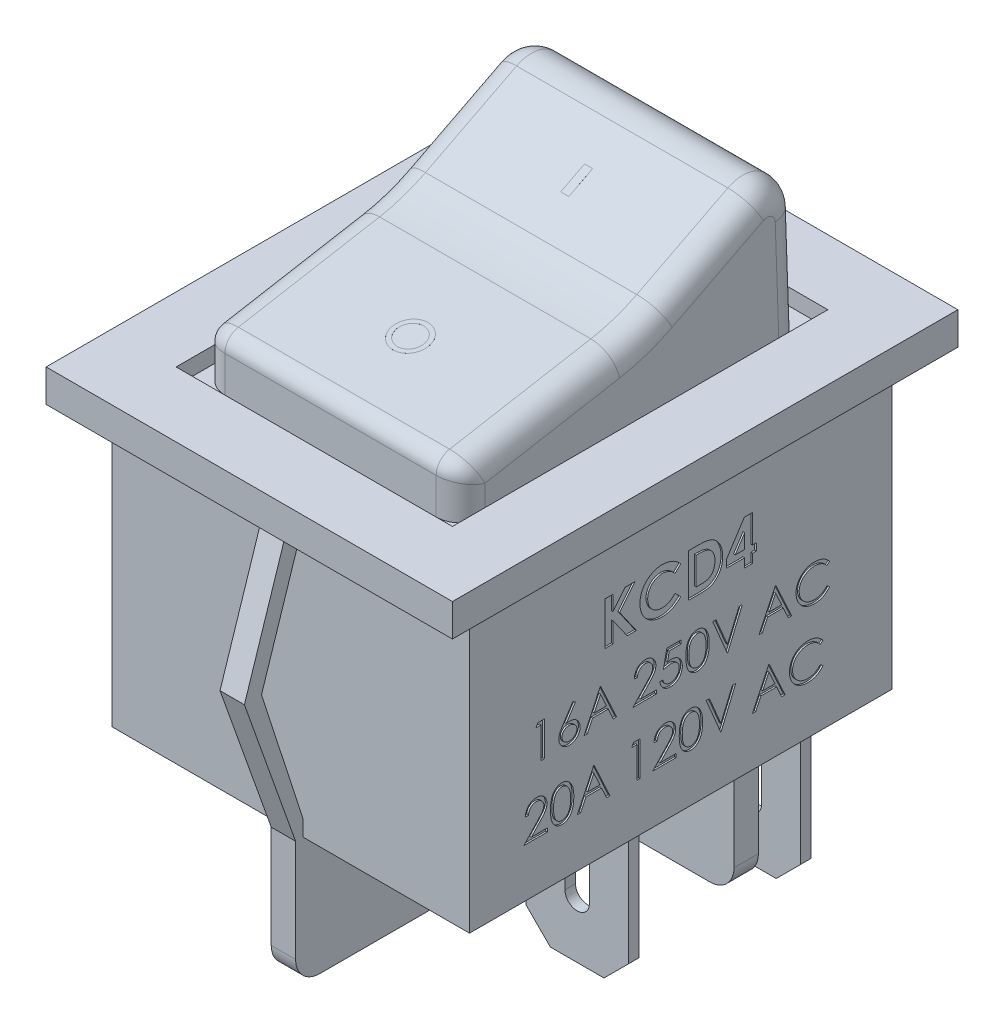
SolidWorks part; units mm, degrees
ref_plane "Front Plane" through (0, 0, 0) normal (0, 0, 1) x (1, 0, 0)
ref_plane "Top Plane" through (0, 0, 0) normal (0, 1, 0) x (1, 0, 0)
ref_plane "Right Plane" through (0, 0, 0) normal (1, 0, 0) x (0, 0, -1)
sketch "Sketch1" plane through (0, 0, 0) normal (0, 1, 0) x (1, 0, 0)
  line L1 (-12.5, 15.55) -> (12.5, 15.55)
  line L2 (-12.5, 15.55) -> (-12.5, -15.55)
  line L3 (-12.5, -15.55) -> (12.5, -15.55)
  line L4 (12.5, 15.55) -> (12.5, -15.55)
  line L5 (-12.5, 15.55) -> (12.5, -15.55) construction
  line L6 (-12.5, -15.55) -> (12.5, 15.55) construction
  point P0 (0, 0)
  dimension "D1" = 31.1
  dimension "D2" = 25
extrude "Boss-Extrude1" add sketch "Sketch1" against normal blind 2
sketch "Sketch2" plane through (0, -2, 0) normal (0, -1, 0) x (1, 0, 0)
  line L4 (0, 17.0982) -> (0, 0) construction
  line L5 (0, 0) -> (6.5468, 0) construction
  line L12 (11, -13) -> (11, 13)
  line L13 (11, 13) -> (-11, 13)
  line L14 (-11, 13) -> (-11, -13)
  line L15 (-11, -13) -> (11, -13)
  dimension "D1" = 22
  dimension "D2" = 26
extrude "Boss-Extrude2" add sketch "Sketch2" along normal blind 17.7
sketch "Sketch4" plane through (0, -19.7, 0) normal (0, -1, 0) x (1, 0, 0)
  line L0 (0, 13.45) -> (0, -13.45) construction
  line L1 (-0.75, 13.45) -> (-0.75, -13.45)
  line L2 (0.75, 13.45) -> (0.75, -13.45)
  line L3 (-0.75, 13.45) -> (0.75, 13.45)
  line L4 (0, 0) -> (2.6117, 0) construction
  line L5 (0.75, -13.45) -> (-0.75, -13.45)
  line L6 (0.75, 19.414) -> (0.75, -21.3873) construction
  line L7 (0, 19.414) -> (0, -21.3873) construction
  line L8 (-0.75, 19.414) -> (-0.75, -21.3873) construction
  dimension "D1" = 0.75
  dimension "D3" = 26.9
  dimension "D2" = 0.75
extrude "Boss-Extrude3" add sketch "Sketch4" along normal blind 7.8
fillet "Fillet1" radius 1.5 2 edges at (0, -27.5, -13.45) (0, -27.5, 13.45)
sketch "Sketch5" plane through (0, 0, 0) normal (1, 0, 0) x (0, 0, -1)
  line L0 (0, 0) -> (0, -10.85) construction
  line L2 (0, -10.85) -> (-13, -10.85) construction
  line L4 (-13, -19.7) -> (-13, -2) construction
  line L6 (-15.55, 0) -> (15.55, 0) construction
  line L7 (-13, -3) -> (-15.55, -10.85)
  line L8 (-15.55, -10.85) -> (-13, -18.7)
  line L9 (-15.55, -2) -> (15.55, -2) construction
  line L10 (13, -19.7) -> (-13, -19.7) construction
  line L11 (-13, -3) -> (-13, -2)
  line L13 (-13.9511, -2.6911) -> (-16.6014, -10.85)
  line L14 (-13.9511, -2.6911) -> (-13.7266, -2)
  line L15 (-13.9511, -2.6911) -> (-16.5011, -10.5411) construction
  line L16 (-13.45, -19.7) -> (-16.6014, -10.85)
  line L17 (-13, -18.7) -> (-13, -19.7)
  line L18 (-13, -19.7) -> (-13.45, -19.7)
  line L19 (-13.7266, -2) -> (-13, -2)
  line L22 (13.7266, -2) -> (13, -2)
  line L23 (13, -19.7) -> (13.45, -19.7)
  line L24 (13, -18.7) -> (13, -19.7)
  line L25 (13.45, -19.7) -> (16.6014, -10.85)
  line L26 (13.9511, -2.6911) -> (13.7266, -2)
  line L27 (13.9511, -2.6911) -> (16.6014, -10.85)
  line L28 (13, -3) -> (13, -2)
  line L29 (15.55, -10.85) -> (13, -18.7)
  line L30 (13, -3) -> (15.55, -10.85)
  dimension "D6" = 2.55
  dimension "D7" = 1
  dimension "D1" = 1
  dimension "D5" = 1
extrude "Boss-Extrude4" add sketch "Sketch5" along normal mid plane 1.5
sketch "Sketch8" plane through (0, 0, 0) normal (0, 1, 0) x (1, 0, 0)
  line L8 (8.5, -11.55) -> (8.5, 11.55)
  line L9 (8.5, 11.55) -> (-8.5, 11.55)
  line L10 (-8.5, 11.55) -> (-8.5, -11.55)
  line L11 (-8.5, -11.55) -> (8.5, -11.55)
  line L12 (8.5, -11.55) -> (8.5, 11.55)
  line L13 (8.5, 11.55) -> (-8.5, 11.55)
  line L14 (-8.5, 11.55) -> (-8.5, -11.55)
  line L15 (-8.5, -11.55) -> (8.5, -11.55)
  dimension "D1" = 4
extrude "Cut-Extrude1" cut sketch "Sketch8" against normal blind 1
sketch "Sketch10" plane through (0, -19.7, 0) normal (0, -1, 0) x (1, 0, 0)
  line L0 (-5.875, 1.25) -> (-5.875, 0.6) construction
  line L1 (2.725, -9.35) -> (9.025, -9.35)
  line L2 (2.725, -9.35) -> (2.725, -10)
  line L3 (2.725, -10) -> (9.025, -10)
  line L4 (9.025, -9.35) -> (9.025, -10)
  line L5 (-9.025, -9.35) -> (-2.725, -9.35)
  line L6 (-9.025, -9.35) -> (-9.025, -10)
  line L7 (-9.025, -10) -> (-2.725, -10)
  line L8 (-2.725, -9.35) -> (-2.725, -10)
  line L9 (-9.025, 1.25) -> (-2.725, 1.25)
  line L10 (-9.025, 1.25) -> (-9.025, 0.6)
  line L11 (-9.025, 0.6) -> (-2.725, 0.6)
  line L12 (-2.725, 1.25) -> (-2.725, 0.6)
  line L13 (2.725, 1.25) -> (9.025, 1.25)
  line L14 (2.725, 1.25) -> (2.725, 0.6)
  line L15 (2.725, 0.6) -> (9.025, 0.6)
  line L16 (9.025, 1.25) -> (9.025, 0.6)
  line L17 (-5.875, 13) -> (-5.875, -13) construction
  line L18 (-0.75, 13) -> (-11, 13) construction
  line L19 (-11, -13) -> (-0.75, -13) construction
  line L20 (-9.025, -9.675) -> (-2.725, -9.675) construction
  line L21 (11, 13) -> (0.75, 13) construction
  line L22 (5.875, 13) -> (5.875, -13) construction
  line L23 (0.75, -13) -> (11, -13) construction
  line L24 (-2.725, 0.925) -> (-9.025, 0.925) construction
  line L26 (-5.875, -10) -> (-5.875, -9.35) construction
  dimension "D1" = 6.3
  dimension "D2" = 6.3
  dimension "6.3" = 6.3
  dimension "D3" = 6.3
  dimension "D4" = 0.65
  dimension "D5" = 0.65
  dimension "D6" = 0.65
  dimension "D7" = 0.65
  dimension "D8" = 3
  dimension "D9" = 3
  dimension "D10" = 10.6
extrude "Boss-Extrude5" add sketch "Sketch10" along normal blind 10
sketch "Sketch11" plane through (0, 0, 1.25) normal (0, 0, 1) x (1, 0, 0)
  line L0 (5.875, -29.7) -> (5.875, -19.7) construction
  line L1 (9.025, -29.7) -> (2.725, -29.7) construction
  line L2 (11, -19.7) -> (0.75, -19.7) construction
  line L3 (-5.875, -29.7) -> (-5.875, -19.7) construction
  line L4 (9.025, -29.7) -> (9.025, -19.7) construction
  line L5 (9.025, -24.7) -> (-9.025, -24.7) construction
  line L6 (-9.025, -29.7) -> (-9.025, -19.7) construction
  line L7 (-2.725, -29.7) -> (-9.025, -29.7) construction
  line L8 (-2.725, -19.7) -> (-9.025, -19.7) construction
  line L9 (-5.875, -23.2) -> (-5.875, -26.2) construction
  line L10 (-5.125, -23.2) -> (-5.125, -26.2)
  line L11 (-6.625, -23.2) -> (-6.625, -26.2)
  line L12 (5.875, -23.2) -> (5.875, -26.2) construction
  line L13 (6.625, -23.2) -> (6.625, -26.2)
  line L14 (5.125, -23.2) -> (5.125, -26.2)
  arc A0 (-5.125, -23.2) -> (-6.625, -23.2) centre (-5.875, -23.2) ccw
  arc A1 (-6.625, -26.2) -> (-5.125, -26.2) centre (-5.875, -26.2) ccw
  arc A2 (6.625, -23.2) -> (5.125, -23.2) centre (5.875, -23.2) ccw
  arc A3 (5.125, -26.2) -> (6.625, -26.2) centre (5.875, -26.2) ccw
  point P20 (-5.875, -24.7)
  point P27 (5.875, -24.7)
  dimension "D1" = 0.75
  dimension "D4" = 0.75
  dimension "D2" = 3
  dimension "D3" = 3
extrude "Cut-Extrude2" cut sketch "Sketch11" against normal through all
chamfer "Chamfer1" distance 1.5 angle 45 8 edges at (-9.025, -29.7, -9.675) (-2.725, -29.7, -9.675) (2.725, -29.7, -9.675) (9.025, -29.7, -9.675) (9.025, -29.7, 0.925) (2.725, -29.7, 0.925) (-2.725, -29.7, 0.925) (-9.025, -29.7, 0.925)
sketch "Sketch12" plane through (0, -19.7, 0) normal (0, -1, 0) x (1, 0, 0)
  line L0 (-11, 13) -> (-11, -13) construction
  line L1 (-11, 0.6) -> (11, 0.6) construction
  line L2 (-11, 0.6) -> (-11, -9.35) construction
  line L3 (-11, -9.35) -> (11, -9.35) construction
  line L4 (11, 0.6) -> (11, -9.35) construction
  line L5 (11, -13) -> (11, 13) construction
  line L6 (-10.65, -4.375) -> (10.65, -4.375) construction
  line L7 (-10.65, -5.125) -> (10.65, -5.125)
  line L8 (-10.65, -3.625) -> (10.65, -3.625)
  line L9 (-10.65, -3.625) -> (-10.65, -5.125)
  line L10 (10.65, -3.625) -> (10.65, -5.125)
  line L11 (0, 0) -> (0, -8.423) construction
  line L12 (-11, -3.625) -> (11, -3.625) construction
  line L13 (-11, -4.375) -> (11, -4.375) construction
  line L14 (-11, -5.125) -> (11, -5.125) construction
  dimension "D1" = 0.75
  dimension "D2" = 0.75
  dimension "D3" = 21.3
extrude "Boss-Extrude6" add sketch "Sketch12" along normal blind 6.5
fillet "Fillet2" radius 1.5 2 edges at (-10.65, -26.2, -4.375) (10.65, -26.2, -4.375)
sketch "Sketch14" plane through (0, 0, 0) normal (1, 0, 0) x (0, 0, -1)
  line L1 (11.55, -1) -> (-11.55, -1) construction
  line L2 (-15.55, -1) -> (15.55, -1)
  line L3 (-15.55, -1) -> (-11.55, -1) construction
  line L4 (10.55, -1) -> (-10.55, -1)
  line L5 (-10.55, -1) -> (-10.55, 1.2213)
  line L6 (-9.7236, 2.2061) -> (-1.0348, 3.7382)
  line L7 (1.7916, 4.6879) -> (7.3993, 7.5635)
  line L8 (-10.55, -1) -> (10.55, -1) construction
  line L10 (10.3107, 5.8536) -> (10.55, -1)
  arc A0 (-9.7236, 2.2061) -> (-10.55, 1.2213) centre (-9.55, 1.2213) ccw
  arc A1 (1.7916, 4.6879) -> (-1.0348, 3.7382) centre (-2.7713, 13.5863) cw
  arc A2 (10.3107, 5.8536) -> (7.3993, 7.5635) centre (8.3119, 5.7838) ccw
  point P14 (0.45, 4)
  point P17 (10.2008, 9)
  point P20 (10.2008, 9)
  dimension "D6" = 10
  dimension "D4" = 10
  dimension "D10" = 1
  dimension "D5" = 2
  dimension "D2" = 1
  dimension "D3" = 1
  dimension "D7" = 5
  dimension "D8" = 88
  dimension "D9" = 100
  dimension "D1" = 1
extrude "Boss-Extrude7" add sketch "Sketch14" along normal mid plane 16
fillet "Fillet3" radius 1.5 14 edges at (-8, 0.1107, 10.55) (8, 0.1107, 10.55) (-8, 2.4268, -10.4303) (-8, 6.1257, -4.5955) (-8, 4.1071, -0.414) (-8, 2.9722, 5.3792) (-8, 1.8641, 10.316) (8, 2.4268, -10.4303) (8, 6.1257, -4.5955) (8, 4.1071, -0.414) (8, 2.9722, 5.3792) (8, 1.8641, 10.316) (-8, 7.5084, -9.3247) (8, 7.5084, -9.3247)
sketch "Sketch15" plane through (0, 3.8024, 0.6705) normal (0, 0.9848, 0.1736) x (1, 0, 0)
  circle A0 centre (0, -5.0369) radius 0.8262
  circle A1 centre (0, -5.0369) radius 1.095
extrude "Boss-Extrude8" add sketch "Sketch15" along normal blind 0.001
sketch "Sketch16" plane through (0, 2.9845, 1.5304) normal (0, 0.8898, 0.4563) x (1, 0, 0)
  line L0 (-6.5, 6.8843) -> (0, 6.8843) construction
  line L1 (-6.5, 10.0353) -> (-6.5, 3.7333) construction
  line L2 (0, 6.8843) -> (0, 0) construction
  line L4 (-0.25, 7.7093) -> (0.25, 7.7093)
  line L5 (-0.25, 7.7093) -> (-0.25, 6.0593)
  line L6 (-0.25, 6.0593) -> (0.25, 6.0593)
  line L7 (0.25, 7.7093) -> (0.25, 6.0593)
  dimension "D1" = 1.65
  dimension "D2" = 0.5
extrude "Boss-Extrude9" add sketch "Sketch16" along normal blind 0.001
sketch "Sketch17" plane through (11, 0, 0) normal (1, 0, 0) x (0, 0, -1)
  line L0 (-13, -8.7) -> (13, -8.7) construction
  line L1 (-13, -19.7) -> (-13, -2) construction
  line L2 (13, -19.7) -> (13, -2) construction
  line L3 (-13, -16.7) -> (13, -16.7) construction
  line L4 (-13, -12.7) -> (13, -12.7) construction
  line L5 (3.625, -19.7) -> (-13, -19.7) construction
  text T0 "<b>KCD4</b>" font "Century Gothic" height in points 10
  text T1 "16A 250V AC" font "Century Gothic" height in points 8
  text T2 "20A 120V AC " font "Century Gothic" height in points 8
  dimension "D1" = 3
  dimension "D2" = 4
  dimension "D3" = 4
extrude "Cut-Extrude3" cut sketch "Sketch17" against normal blind 0.1
